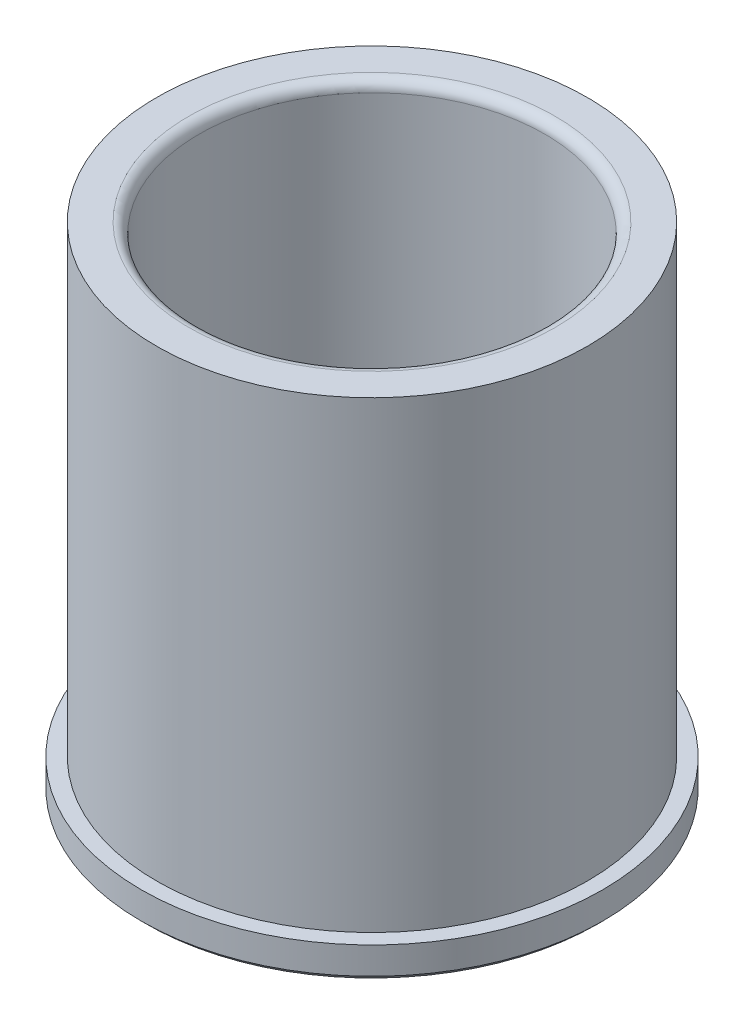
SolidWorks part; units mm, degrees
ref_plane "Front Plane" through (0, 0, 0) normal (0, 0, 1) x (1, 0, 0)
ref_plane "Top Plane" through (0, 0, 0) normal (0, 1, 0) x (1, 0, 0)
ref_plane "Right Plane" through (0, 0, 0) normal (1, 0, 0) x (0, 0, -1)
sketch "Sketch1" plane through (0, 0, 0) normal (0, 0, 1) x (1, 0, 0)
  line L0 (-33.2359, 0) -> (-33.9979, 0.762)
  line L1 (0, -1000) -> (0, 49000) construction
  line L2 (-25.4635, 73.025) -> (-25.4635, 0.762)
  line L3 (-26.2255, 0) -> (-33.2359, 0)
  line L4 (-33.9979, 0.762) -> (-33.9979, 4.7625)
  line L5 (-33.9979, 4.7625) -> (-31.7563, 4.7625)
  line L6 (-31.7564, 73.025) -> (-31.7563, 4.7625)
  line L7 (-31.7564, 73.025) -> (-25.4635, 73.025)
  line L8 (-26.2255, 0) -> (-25.4635, 0.762)
  dimension "OD" = 63.5127
  dimension "ID" = 50.927
  dimension "H" = 67.9958
  dimension "D2" = 45
  dimension "OVERALL LENGTH" = 73.025
  dimension "D4" = 0.762
  dimension "D5" = 135
  dimension "T" = 4.7625
revolve "Revolve1" add sketch "Sketch1" angle 360 about L1
fillet "Fillet1" radius 1.524 1 edges at (25.4635, 73.025, 0)
